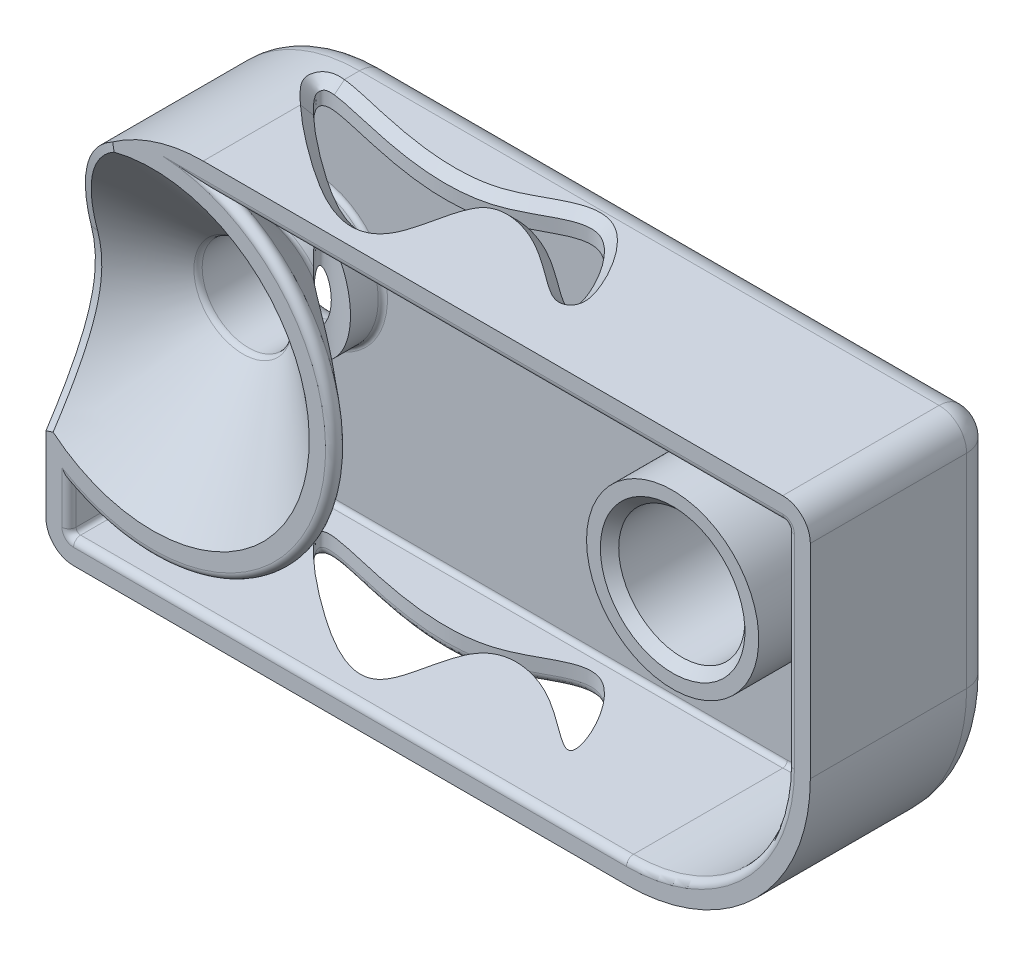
SolidWorks part; units mm, degrees
ref_plane "Ebene vorne" through (0, 0, 0) normal (0, 0, 1) x (1, 0, 0)
ref_plane "Ebene oben" through (0, 0, 0) normal (0, 1, 0) x (1, 0, 0)
ref_plane "Ebene rechts" through (0, 0, 0) normal (1, 0, 0) x (0, 0, -1)
sketch "Skizze1" plane through (0, 0, 0) normal (0, 0, 1) x (1, 0, 0)
  line L1 (-21.8645, 15.1002) -> (44.1635, 15.1002)
  line L2 (-38.9597, -1.995) -> (-38.9597, -30.0648)
  line L3 (-38.9597, -30.0648) -> (24.1635, -30.0648)
  line L4 (44.1635, 15.1002) -> (44.1635, -10.0648)
  arc A0 (-38.9597, -1.995) -> (-21.8645, 15.1002) centre (-21.8645, -1.995) cw
  arc A1 (44.1635, -10.0648) -> (24.1635, -30.0648) centre (24.1635, -10.0648) cw
  circle A2 centre (-27.3723, -5.4213) radius 5.0454
  circle A3 centre (29.1889, 0.2537) radius 6.8634
  dimension "D2" = 20
extrude "Linear austragen1" add sketch "Skizze1" along normal blind 20
chamfer "Fase1" distance 12 angle 40 1 edges at (-22.3269, -5.4213, 20)
fillet "Verrundung1" radius 3 3 edges at (44.1635, 2.5177, 0) (38.3057, -24.207, 0) (-7.3981, -30.0648, 0)
fillet "Verrundung2" radius 3 7 edges at (44.1635, 15.1002, 11.5) (9.6495, 15.1002, 0) (43.2849, 15.1002, 0.8787) (-38.9597, -29.1861, 0.8787) (-38.9597, -14.5299, 0) (-33.9527, 10.0931, 0) (-38.9597, -30.0648, 11.5)
fillet "Verrundung4" radius 3 1 edges at (-22.3269, -5.4213, 0)
shell "Wandung1" thickness 2.5
fillet "Verrundung10" radius 1 1 edges at (-19.8269, -5.4213, 8.765)
fillet "Verrundung15" radius 0.8 1 edges at (-32.4178, -5.4213, 9.9308)
ref_plane "Ebene2" through (24.1635, -30.0648, 3) normal (0, 0, -1) x (-1, 0, 0)
sketch "Skizze3" plane through (0, 15.1002, 0) normal (0, 1, 0) x (-1, 0, 0)
  spline_without_curve S0
extrude "Schnitt-Linear austragen1" cut sketch "Skizze3" against normal blind 60
fillet "Verrundung19" radius 1 1 edges
chamfer "Fase2" distance 2 angle 45 1 edges at (36.0523, 0.2537, 0)
chamfer "Fase4" distance 1 angle 45 3 edges at (-21.8645, 15.1002, 4.3239) (-23.253, 15.0437, 5.8652)
chamfer "Fase10" distance 1 angle 45 1 edges at (36.0523, 0.2537, 20)
chamfer "Fase11" distance 1 angle 45 5 edges at (-38.9597, -22.4936, 20) (-10.625, -8.5954, 20) (-38.9597, -1.995, 9.4182) (-38.9597, -9.1118, 15.9014) (-37.9872, 3.6887, 17.4346)
fillet "Verrundung20" radius 0.77 9 edges at (41.6635, 1.0177, 20) (41.5171, 12.4537, 20) (12.2222, 12.6002, 20) (-8.9152, -15.3005, 20) (-36.4597, -25.6728, 20) (-36.3133, -27.4184, 20) (-5.8981, -27.5648, 20) (36.5379, -22.4392, 20) (-36.4597, -7.5948, 10.274)
